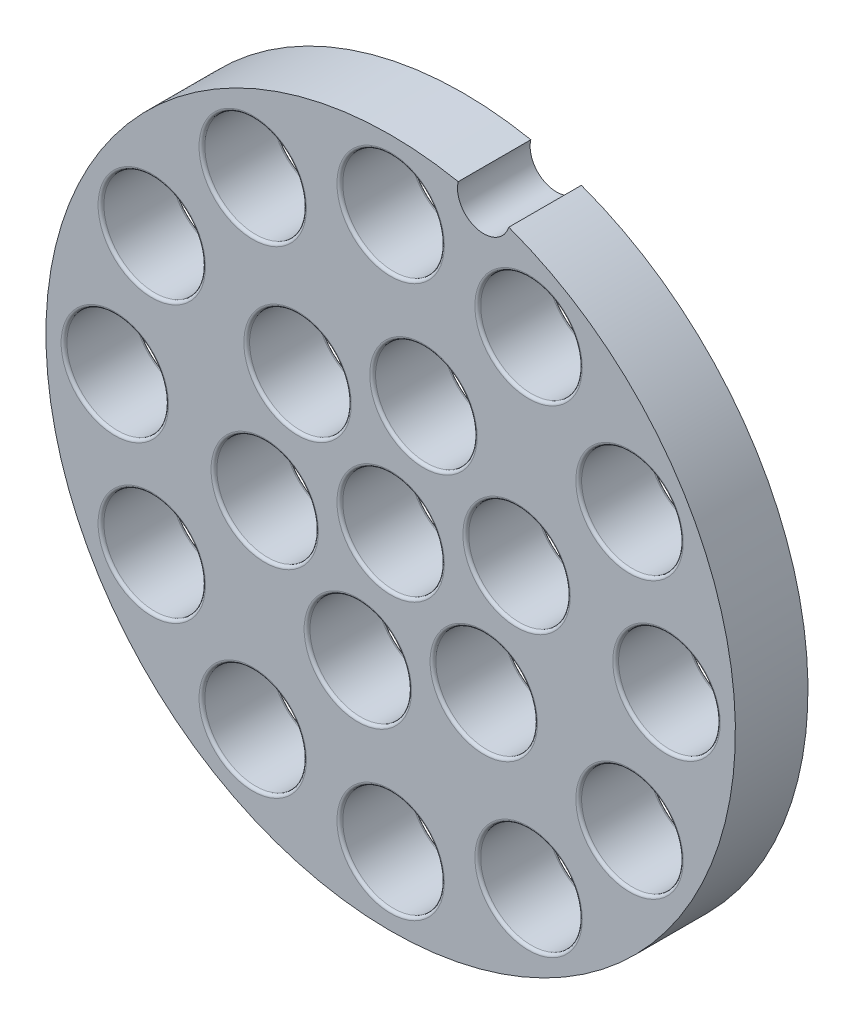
SolidWorks part; units mm, degrees
ref_plane "Plane1" through (0, 0, 0) normal (0, 0, 1) x (1, 0, 0)
ref_plane "Plane2" through (0, 0, 0) normal (0, 1, 0) x (1, 0, 0)
ref_plane "Plane3" through (0, 0, 0) normal (1, 0, 0) x (0, 0, -1)
sketch "Sketch1" plane through (0, 0, 0) normal (0, 0, 1) x (1, 0, 0)
  circle A0 centre (0, 0) radius 27
  dimension "D1" = 54
extrude "Base-Extrude" add sketch "Sketch1" along normal blind 5
sketch "Sketch2" plane through (0, 0, 5) normal (0, 0, 1) x (1, 0, 0)
  circle A0 centre (0, 19) radius 3.5
  dimension "D1" = 7
  dimension "D2" = 19
extrude "Cut-Extrude1" cut sketch "Sketch2" against normal blind 5
pattern_circular "CirPattern1" count 12 every 30
sketch "Sketch3" plane through (0, 0, 5) normal (0, 0, 1) x (1, 0, 0)
  line L0 (0, 0) -> (0, 30.5543) construction
  line L1 (0, 0) -> (15.9312, 27.6577) construction
  line L2 (0, 0) -> (8.3627, 32.0493) construction
  circle A0 centre (2.2598, 8.7117) radius 3.5
  dimension "D1" = 7
  dimension "D2" = 9
extrude "Cut-Extrude2" cut sketch "Sketch3" against normal blind 5
pattern_circular "CirPattern2" count 6 every 60
sketch "Sketch4" plane through (0, 0, 5) normal (0, 0, 1) x (1, 0, 0)
  circle A0 centre (0, 0) radius 3.5
  dimension "D1" = 7
extrude "Cut-Extrude3" cut sketch "Sketch4" against normal blind 5
sketch "Sketch5" plane through (0, 0, 5) normal (0, 0, 1) x (1, 0, 0)
  line L0 (0, 0) -> (7.8401, -28.6855) construction
  circle A0 centre (7.0554, -25.8142) radius 2.5
  circle A1 centre (0, 0) radius 27 construction
  dimension "D1" = 26.761
  dimension "D2" = 5
extrude "Cut-Extrude4" cut sketch "Sketch5" against normal blind 5
fillet "Fillet1" radius 0.2
fillet "Fillet2" radius 0.2
sketch "Sketch7" plane through (0, 0, 5) normal (0, 0, 1) x (1, 0, 0)
  circle A0 centre (0, 0) radius 23.7464
  circle A1 centre (0, 0) radius 30.5207
extrude "Cut-Extrude5" cut sketch "Sketch7" against normal blind 5
sketch "Sketch8" plane through (0, 0, 5) normal (0, 0, 1) x (1, 0, 0)
  circle A0 centre (6.4146, 22.8636) radius 1.8095
  circle A1 centre (0, 0) radius 23.7464 construction
extrude "Cut-Extrude6" cut sketch "Sketch8" against normal blind 5
